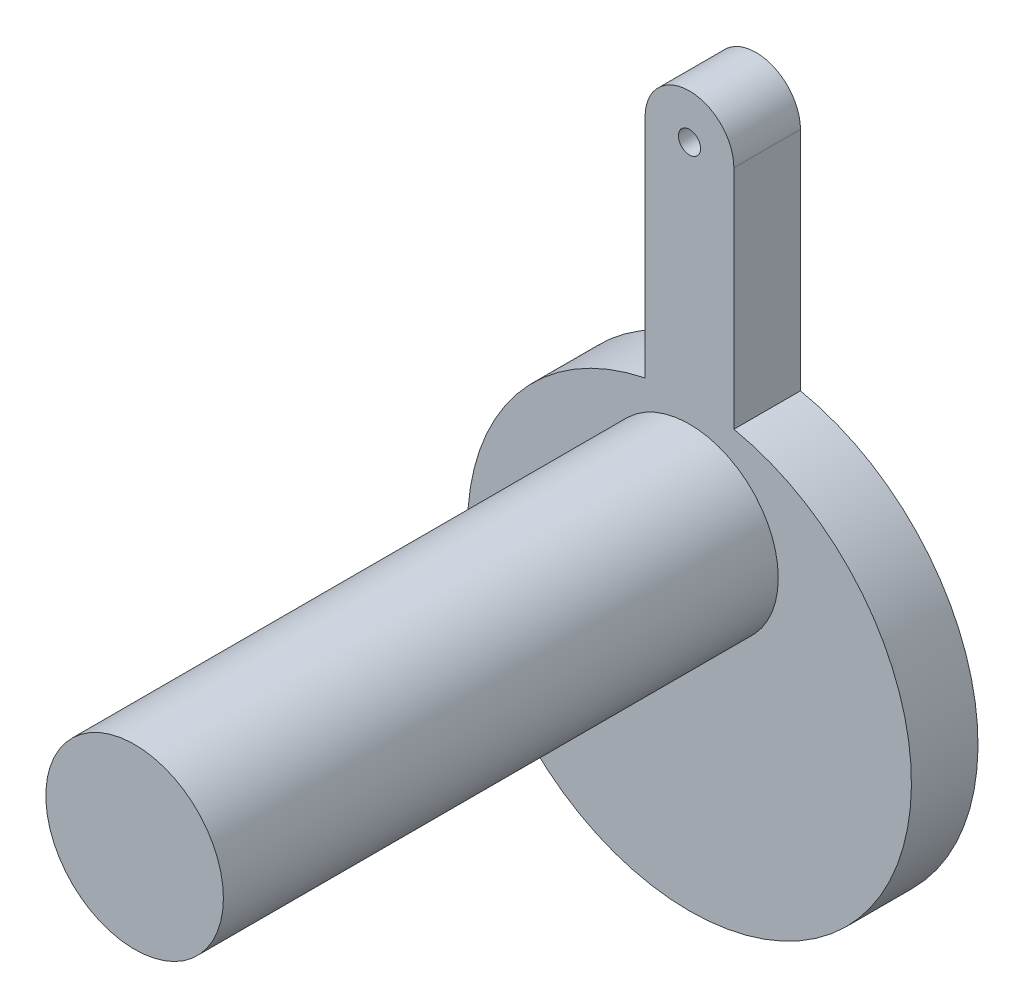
SolidWorks part; units mm, degrees
ref_plane "Ön Düzlem" through (0, 0, 0) normal (0, 0, 1) x (1, 0, 0)
ref_plane "Üst Düzlem" through (0, 0, 0) normal (0, 1, 0) x (1, 0, 0)
ref_plane "Sağ Düzlem" through (0, 0, 0) normal (1, 0, 0) x (0, 0, -1)
sketch "Çizim1" plane through (0, 0, 0) normal (0, 0, 1) x (1, 0, 0)
  line L2 (-20, 55) -> (-20, -47.0204)
  line L4 (20, 55) -> (20, -47.0204)
  line L5 (-20, 55) -> (20, -55) construction
  line L6 (-20, -55) -> (20, 55) construction
  arc A0 (-20, 55) -> (20, 55) centre (0, 55) cw
  arc A1 (-20, -47.0204) -> (20, -47.0204) centre (0, -145) ccw
  point P0 (0, 0)
  dimension "D3" = 200
  dimension "D1" = 40
  dimension "D2" = 110
  dimension "D4" = 200
extrude "Yükseklik-Ekstrüzyon1" add sketch "Çizim1" along normal blind 30
sketch "Çizim2" plane through (0, 0, 30) normal (0, 0, 1) x (1, 0, 0)
  circle A0 centre (0, 55) radius 5
  circle A1 centre (0, -95) radius 20
  arc A2 (20, 55) -> (-20, 55) centre (0, 55) ccw construction
  point P4 (0, 75)
  dimension "D1" = 10
  dimension "D2" = 40
  dimension "D3" = 150
  dimension "D4" = 20
extrude "Kes-Ekstrüzyon1" cut sketch "Çizim2" against normal blind 30
sketch "Çizim3" plane through (0, 0, 30) normal (0, 0, 1) x (1, 0, 0)
  circle A0 centre (0, -95) radius 40
  dimension "D1" = 80
extrude "Kes-Ekstrüzyon3" cut sketch "Çizim3" against normal blind 40
sketch "Çizim4" plane through (0, 0, 30) normal (0, 0, 1) x (1, 0, 0)
  circle A0 centre (0, -95) radius 40
  dimension "D1" = 80
extrude "Yükseklik-Ekstrüzyon2" add sketch "Çizim4" along normal blind 250 and the other way blind 30
